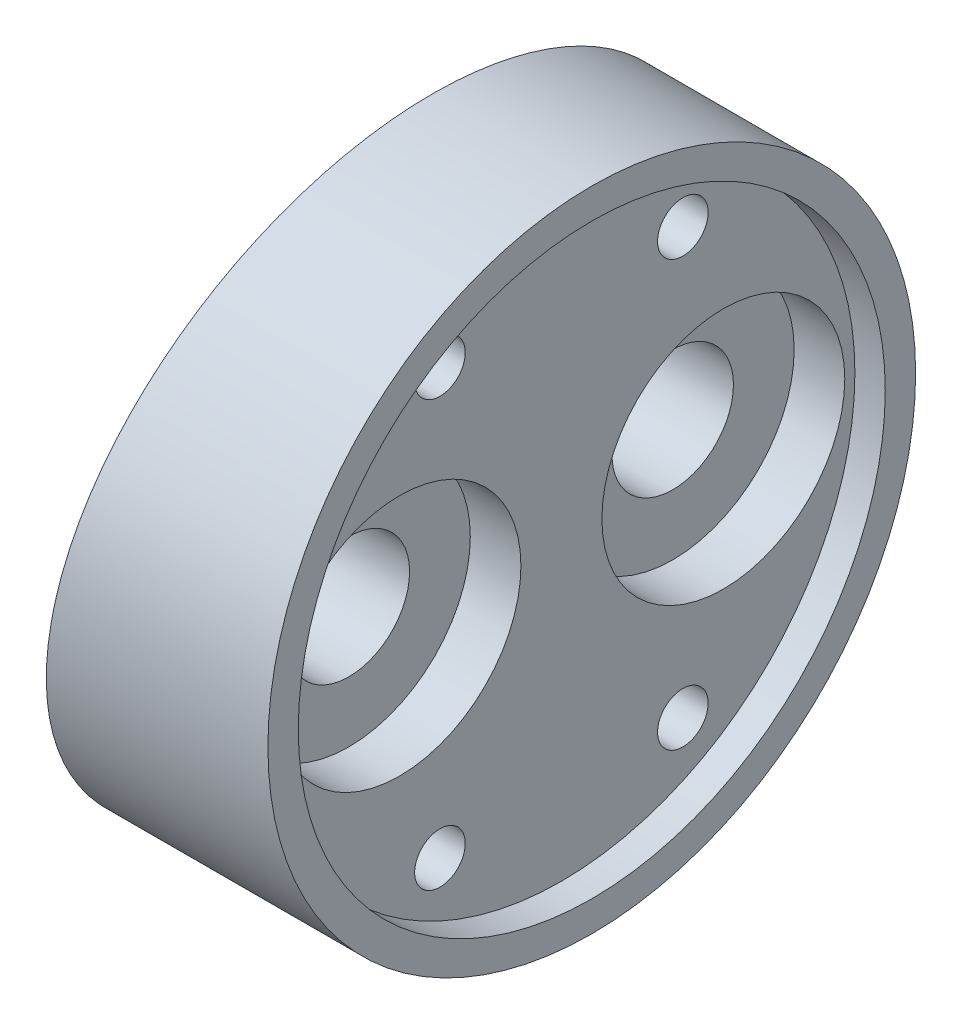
SolidWorks part; units mm, degrees
ref_plane "Vorne" through (0, 0, 0) normal (0, 0, 1) x (1, 0, 0)
ref_plane "Oben" through (0, 0, 0) normal (0, 1, 0) x (1, 0, 0)
ref_plane "Rechts" through (0, 0, 0) normal (1, 0, 0) x (0, 0, -1)
sketch "Skizze1" plane through (0, 0, 0) normal (0, 0, 1) x (1, 0, 0)
  line L0 (10.7, 16) -> (-3.12, 16) construction
  line L1 (10.7, 0) -> (10.7, 16) construction
  line L2 (-3.12, 16) -> (-3.12, 0) construction
  line L3 (10.7, 16) -> (-3.12, 16)
  line L4 (10.7, 0) -> (10.7, 16)
  line L5 (-3.12, 16) -> (-3.12, 0)
  line L6 (-200068.1765, 0) -> (200114.16, 0) construction
  line L7 (-200068.1765, 0) -> (200114.16, 0)
  line L8 (10.7, 0) -> (-3.12, 0)
revolve "Rotation1" add sketch "Skizze1" angle 360 about L7
sketch "Skizze2" plane through (0, 0, 0) normal (0, 0, 1) x (1, 0, 0)
  line L0 (-2.8212, -16) -> (2.8212, 16)
  line L2 (10.7, 16) -> (-3.12, 16) construction
  line L3 (2.8212, 16) -> (-3.12, 16)
  line L4 (-3.12, -16) -> (10.7, -16) construction
  line L5 (-2.8212, -16) -> (-3.12, -16)
  line L6 (-3.12, 16) -> (-3.12, -16) construction
  line L7 (-3.12, -16) -> (-3.12, 16)
  dimension "D1" = 80
extrude "Schnitt-Linear austragen1" cut sketch "Skizze2" against normal mid plane 100
hole_wizard "Ø6.0 (6) Durchmesser Bohrung1" positions "Skizze4" profile "Skizze3" hole size "Ø6.0" standard "ISO"
sketch "Skizze4" plane through (10.7, 0, 0) normal (1, 0, 0) x (0, 0, -1)
  line L0 (0, 0) -> (0, 6.6552) construction
  point P0 (8, 0)
  point P1 (-8, 0)
  dimension "D1" = 16
sketch "Skizze3" plane through (10.7, 0, -8) normal (0, 1, 0) x (0, 0, -1)
  line L0 (0, 0) -> (0, 10.5321)
  line L1 (0, 10.5321) -> (3, 8.8)
  line L2 (3, 8.8) -> (3, 0)
  line L5 (3, 0) -> (0, 0)
  line L10 (0, 10.5321) -> (-3, 8.8) construction
  line L11 (0, -6.35) -> (0, 107.95) construction
  dimension "Bohrerdurchmesser" = 6
  dimension "Bohrungstiefe" = 8.8
  dimension "Spitzenwinkel" = 120
hole_wizard "Ø0.15 (0.15) Durchmesser Bohrung1" positions "Skizze6" profile "Skizze5" hole size "Ø0.15" standard "ISO"
sketch "Skizze6" plane through (10.7, 0, 0) normal (1, 0, 0) x (0, 0, -1)
  point P0 (8, 0)
  point P1 (-8, 0)
sketch "Skizze5" plane through (10.7, 0, -8) normal (0, 1, 0) x (0, 0, -1)
  line L0 (0, 0) -> (0, 13.5212)
  line L1 (0, 13.5212) -> (0.075, 13.5212)
  line L2 (0.075, 13.5212) -> (0.075, 0)
  line L5 (0.075, 0) -> (0, 0)
  line L11 (0, -6.35) -> (0, 107.95) construction
  dimension "Bohrerdurchmesser" = 0.15
  dimension "Bohrungstiefe" = 13.5212
sketch "Skizze9" plane through (10.7, 0, 0) normal (1, 0, 0) x (0, 0, -1)
  circle A0 centre (0, 0) radius 14.5
  dimension "D1" = 29
extrude "Schnitt-Linear austragen4" cut sketch "Skizze9" against normal blind 1.5
hole_wizard "M3 Gewindebohrung1" positions "Skizze11" profile "Skizze10" tap size "M3" standard "ISO"
sketch "Skizze11" plane through (9.2, 0, 0) normal (1, 0, 0) x (0, 0, -1)
  line L1 (-6, -10.5) -> (6, -10.5)
  line L2 (-6, -10.5) -> (-6, 10.5)
  line L3 (-6, 10.5) -> (6, 10.5)
  line L4 (6, -10.5) -> (6, 10.5)
  line L5 (-6, 0) -> (0, 0) construction
  line L6 (0, 0) -> (0, 10.5) construction
  point P0 (6, 10.5)
  point P1 (-6, 10.5)
  point P3 (-6, -10.5)
  point P5 (6, -10.5)
  dimension "D1" = 12
  dimension "D2" = 21
sketch "Skizze10" plane through (9.2, 10.5, -6) normal (0, 1, 0) x (0, 0, -1)
  line L0 (0, 0) -> (0, 6.7511)
  line L1 (0, 6.7511) -> (1.25, 6)
  line L2 (1.25, 6) -> (1.25, 0)
  line L5 (1.25, 0) -> (0, 0)
  line L10 (0, 6.7511) -> (-1.25, 6) construction
  line L11 (0, -6.35) -> (0, 107.95) construction
  dimension "Bohrerdurchmesser" = 2.5
  dimension "Bohrungstiefe" = 6
  dimension "Spitzenwinkel" = 118
sketch "Skizze7" plane through (10.7, 0, 0) normal (1, 0, 0) x (0, 0, -1)
  circle A0 centre (-8, 0) radius 6
  circle A1 centre (8, 0) radius 6
  dimension "D1" = 12
extrude "Schnitt-Linear austragen2" cut sketch "Skizze7" against normal blind 4
